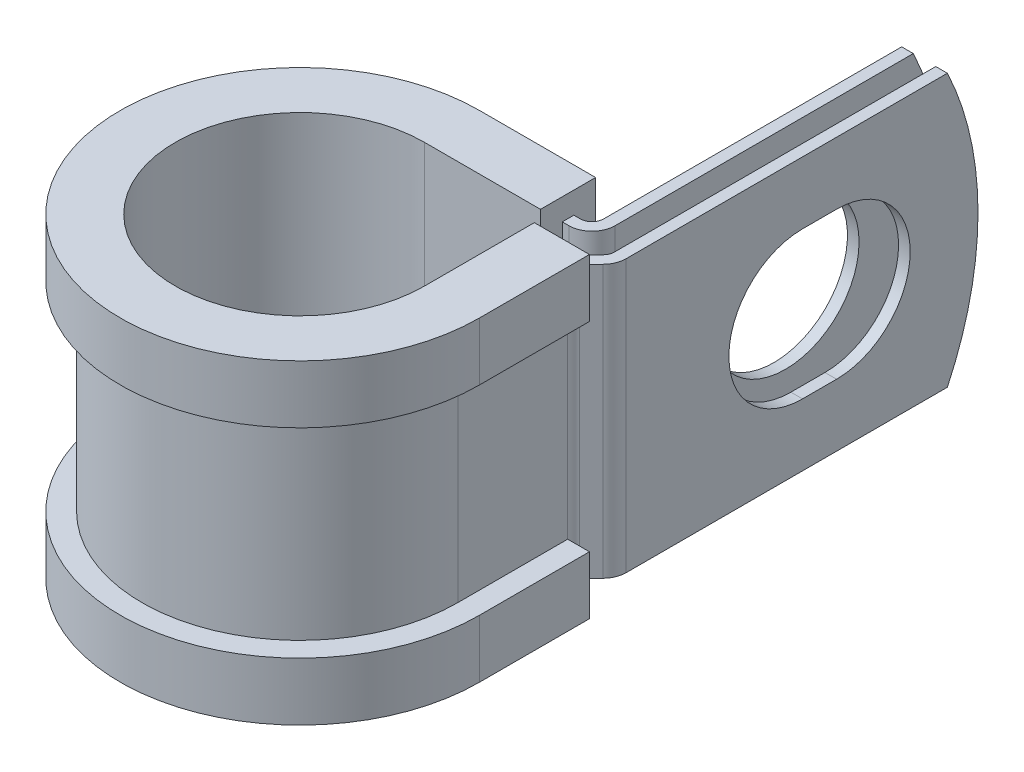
SolidWorks part; units mm, degrees
ref_plane "Front Plane" through (0, 0, 0) normal (0, 0, 1) x (1, 0, 0)
ref_plane "Top Plane" through (0, 0, 0) normal (0, 1, 0) x (1, 0, 0)
ref_plane "Right Plane" through (0, 0, 0) normal (1, 0, 0) x (0, 0, -1)
sketch "Sketch1" plane through (0, 0, 0) normal (0, 1, 0) x (1, 0, 0)
  line L0 (0, 10.2489) -> (8.5889, 10.2489)
  line L1 (10.2489, 0) -> (10.2489, 7.6985)
  line L2 (10.2145, 34.8996) -> (10.2145, 11.8745)
  line L3 (10.725, 8.848) -> (11.5512, 9.6742)
  line L5 (11.7893, 10.2489) -> (11.7893, 34.8996)
  arc A0 (0, 10.2489) -> (10.2489, 0) centre (0, 0) ccw
  arc A1 (10.725, 8.848) -> (10.2489, 7.6985) centre (11.8745, 7.6985) ccw
  arc A2 (11.5512, 9.6742) -> (11.7893, 10.2489) centre (10.9765, 10.2489) ccw
  arc A3 (8.5889, 10.2489) -> (10.2145, 11.8745) centre (8.5889, 11.8745) ccw
extrude "Extrude-Thin1" add sketch "Sketch1" along normal mid plane 19.05 thin
sketch "Sketch2" plane through (9.4017, 0, 0) normal (-1, 0, 0) x (0, 0, 1)
  line L0 (-34.8996, 9.525) -> (-34.8996, -9.525) construction
  line L1 (0, 9.525) -> (0, -9.525) construction
  circle A0 centre (-23.7998, 0) radius 5.1562
  point P2 (-34.8996, 0)
extrude "Cut-Extrude1" cut sketch "Sketch2" against normal up to surface (0.8128 mm away)
sketch "Sketch3" plane through (12.6021, 0, 0) normal (1, 0, 0) x (0, 0, -1)
  line L0 (22.606, 0) -> (24.9936, 0) construction
  line L1 (22.606, 5.1562) -> (24.9936, 5.1562)
  line L2 (22.606, -5.1562) -> (24.9936, -5.1562)
  line L3 (34.8996, 9.525) -> (34.8996, -9.525) construction
  arc A0 (22.606, 5.1562) -> (22.606, -5.1562) centre (22.606, 0) ccw
  arc A1 (24.9936, -5.1562) -> (24.9936, 5.1562) centre (24.9936, 0) ccw
  point P3 (23.7998, 0)
  point P8 (34.8996, 0)
  point P11 (17.4498, 0)
  point P12 (30.1498, 0)
extrude "Cut-Extrude2" cut sketch "Sketch3" against normal up to surface (0.8128 mm away)
sketch "Sketch4" plane through (9.4017, 0, 0) normal (-1, 0, 0) x (0, 0, 1)
  line L0 (-34.8996, 9.525) -> (-34.8996, -9.525)
  line L1 (-34.8996, 9.525) -> (-32.7551, 9.525)
  line L2 (-34.8996, 9.525) -> (-11.8745, 9.525) construction
  line L3 (-34.8996, -9.525) -> (-32.7551, -9.525)
  line L4 (-34.8996, -9.525) -> (-11.8745, -9.525) construction
  arc A0 (-32.7551, 9.525) -> (-32.7551, -9.525) centre (-12.6746, 0) ccw
extrude "Cut-Extrude3" cut sketch "Sketch4" against normal through all contours A0 M4 M5 | A0 L0 M2
ref_plane "Plane1" through (0, 0, -7.6985) normal (0, 0, -1) x (-1, 0, 0)
ref_plane "Plane2" through (8.1317, 0, 0) normal (-1, 0, 0) x (0, 0, 1)
sketch "Sketch5" plane through (0, 0, -7.6985) normal (0, 0, -1) x (-1, 0, 0)
  line L0 (-11.0617, 9.525) -> (-10.2489, 9.525)
  line L1 (-11.0617, 9.525) -> (-11.0617, -9.525) construction
  line L3 (-10.2489, 9.525) -> (-10.2489, -9.525)
  line L4 (-10.2489, -9.525) -> (-11.0617, -9.525)
  line L5 (-11.0617, -9.525) -> (-11.0617, -6.985)
  line L6 (-11.0617, 9.525) -> (-11.0617, 6.985)
  line L7 (-12.5857, 11.049) -> (-12.5857, 6.985)
  line L8 (-12.5857, 11.049) -> (-8.7249, 11.049)
  line L9 (-8.7249, 11.049) -> (-8.7249, -11.049)
  line L10 (-8.7249, -11.049) -> (-12.5857, -11.049)
  line L11 (-12.5857, -11.049) -> (-12.5857, -6.985)
  line L12 (-12.5857, 6.985) -> (-11.0617, 6.985)
  line L13 (-11.0617, -6.985) -> (-12.5857, -6.985)
sketch "Sketch6" plane through (0, 9.525, 0) normal (0, 1, 0) x (1, 0, 0)
  line L0 (8.7249, 0) -> (8.7249, 7.6985)
  line L1 (8.7249, 7.6985) -> (12.5857, 7.6985) construction
  line L2 (8.1317, 6.9878) -> (8.1317, -6.9878) construction
  line L5 (0, 8.7249) -> (8.1317, 8.7249)
  arc A0 (0, 8.7249) -> (8.7249, 0) centre (0, 0) ccw
sweep "Sweep1" add profiles "Sketch5" path "Sketch6"
equation "\"D4@Sketch5\" = \"D1@Extrude-Thin1\""
equation "\"D5@Sketch5\" = \"D5@Extrude-Thin1\""
equation "\"D1@Sketch3\" = \"D2@Sketch2\""
equation "\"D7@Sketch1\" = \"D3@Sketch2\" + \"D1@Sketch3\""
equation "\"D1@Sketch1\" = \"D1@Sketch6\" + 2 * \"D3@Sketch5\""
equation "\"D1@Sketch4\" = ( \"D1@Extrude-Thin1\" + .125 ) * 2"
equation "\"D9@Sketch1\"= \"D5@Extrude-Thin1\""
equation "\"D8@Sketch1\"= 2 * \"D5@Extrude-Thin1\""
equation "\"D2@Sketch1\" = 2 * \"D5@Extrude-Thin1\""
equation "\"D2@Sketch3\" = \"D1@Sketch2\""
